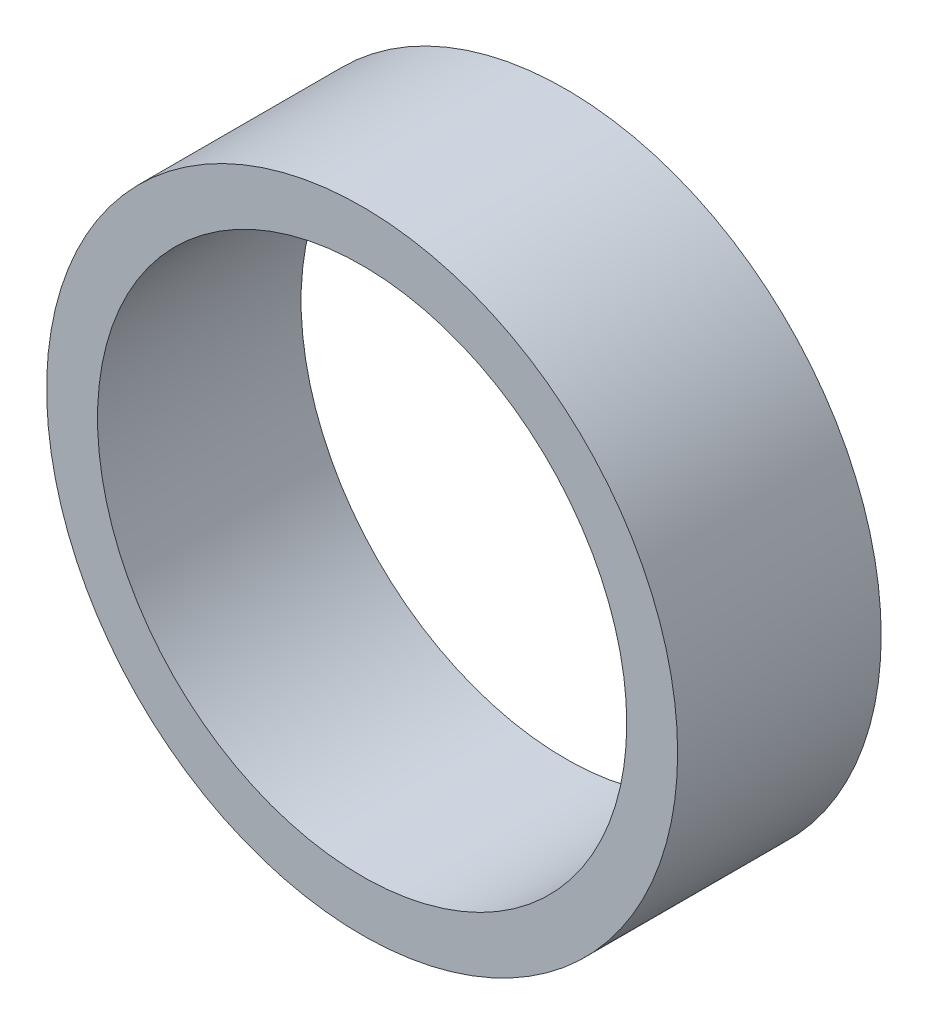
SolidWorks part; units mm, degrees
ref_plane "Спереди" through (0, 0, 0) normal (0, 0, 1) x (1, 0, 0)
ref_plane "Сверху" through (0, 0, 0) normal (0, 1, 0) x (1, 0, 0)
ref_plane "Справа" through (0, 0, 0) normal (1, 0, 0) x (0, 0, -1)
sketch "Sketch1" plane through (0, 0, 0) normal (0, 0, 1) x (1, 0, 0)
  circle A0 centre (0, 0) radius 31
  circle A1 centre (0, 0) radius 26
  dimension "D1" = 62
  dimension "D2" = 5
extrude "Extrude1" add sketch "Sketch1" along normal blind 20
